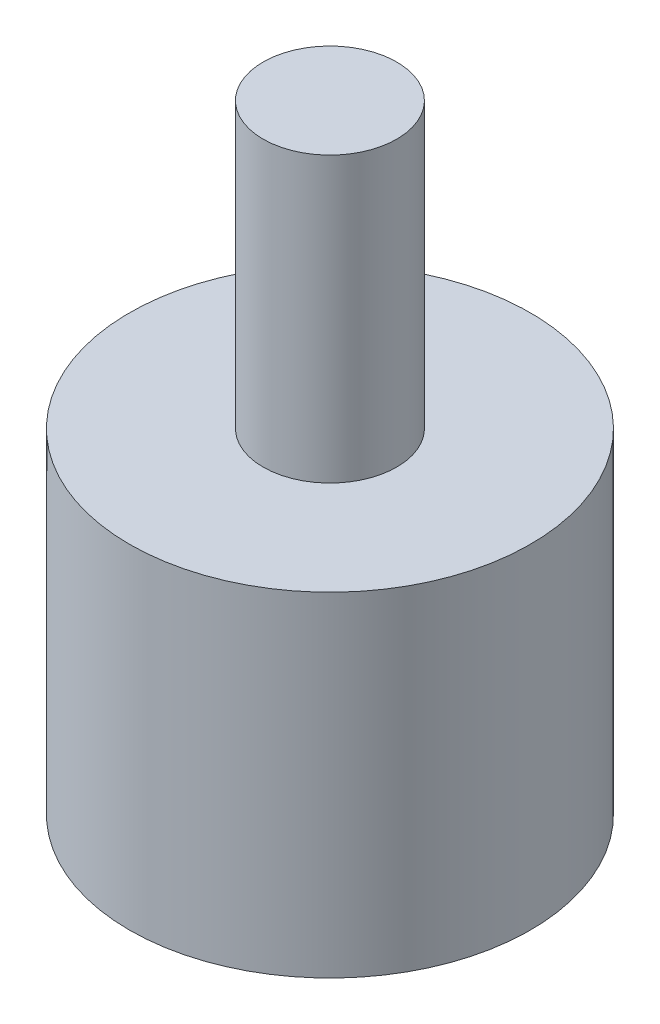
SolidWorks part; units mm, degrees
ref_plane "前视基准面" through (0, 0, 0) normal (0, 0, 1) x (1, 0, 0)
ref_plane "上视基准面" through (0, 0, 0) normal (0, 1, 0) x (1, 0, 0)
ref_plane "右视基准面" through (0, 0, 0) normal (1, 0, 0) x (0, 0, -1)
sketch "草图1" plane through (0, 0, 0) normal (0, 1, 0) x (1, 0, 0)
  circle A0 centre (0, 0) radius 12
  dimension "D1" = 24
extrude "凸台-拉伸1" add sketch "草图1" along normal blind 20
sketch "草图2" plane through (0, 20, 0) normal (0, 1, 0) x (1, 0, 0)
  circle A0 centre (0, 0) radius 4
  dimension "D1" = 8
extrude "凸台-拉伸2" add sketch "草图2" along normal blind 17
